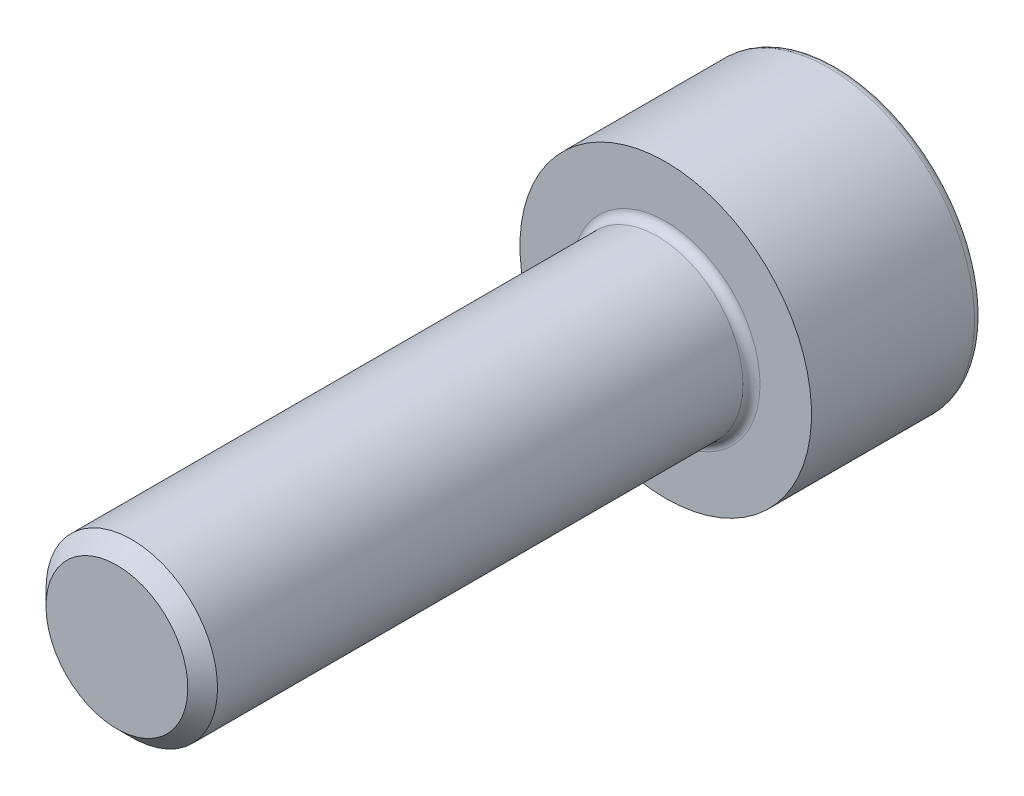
SolidWorks part; units mm, degrees
ref_plane "Plan1" through (0, 0, 0) normal (0, 0, 1) x (1, 0, 0)
ref_plane "Plan2" through (0, 0, 0) normal (0, 1, 0) x (1, 0, 0)
ref_plane "Plan3" through (0, 0, 0) normal (1, 0, 0) x (0, 0, -1)
sketch "Sketch1" plane through (0, 0, 0) normal (1, 0, 0) x (0, 0, -1)
  line L0 (5, 0) -> (-16, 0) construction
  line L1 (5, 0) -> (5, 4.25)
  line L2 (5, 4.25) -> (0, 4.25)
  line L3 (0, 4.25) -> (0, 2.5)
  line L4 (0, 2.5) -> (-16, 2.5)
  line L5 (-16, 2.5) -> (-16, 0)
  line L6 (-16, 0) -> (5, 0)
  line L7 (5, 0) -> (4.2, 0) construction
  dimension "DK" = 8.5
  dimension "L" = 16
  dimension "K" = 5
  dimension "D" = 5
  dimension "P" = 0.8
revolve "Base-Revolve" add sketch "Sketch1"
chamfer "Chamfer1" distance 0.433 angle 45 1 edges at (0, 2.5, 16)
fillet "Fillet1" radius 0.25 2 edges at (0, 4.25, -5) (0, 2.5, 0)
hole_wizard "Hole1" positions "Sketch3" profile "Sketch2" legacy
sketch "Sketch3" plane through (0, 0, -5) normal (0, 0, -1) x (-1, 0, 0)
  circle A0 centre (0, 0) radius 4.25 construction
  point P0 (0, 0)
sketch "Sketch2" plane through (0, 0, -5) normal (1, 0, 0) x (0, 1, 0)
  line L0 (0, 0) -> (0, 3.6547)
  line L1 (0, 3.6547) -> (2, 2.5)
  line L2 (2, 2.5) -> (2, 0)
  line L4 (2, 0) -> (0, 0)
  line L6 (0, 3.6547) -> (-2, 2.5) construction
  line L7 (0, -4.2442) -> (0, 117.3081) construction
  dimension "Diameter" = 4
  dimension "Depth" = 2.5
  dimension "Drill Angle" = 120
sketch "Sketch4" plane through (0, 0, -5) normal (0, 0, -1) x (-1, 0, 0)
  line L0 (0, -2) -> (0, 2) construction
  line L1 (2.3094, 0) -> (-2.3094, 0) construction
  line L2 (1.1547, 2) -> (-1.1547, 2)
  line L3 (-1.1547, 2) -> (-2.3094, 0)
  line L4 (-2.3094, 0) -> (-1.1547, -2)
  line L5 (-1.1547, -2) -> (1.1547, -2)
  line L6 (1.1547, -2) -> (2.3094, 0)
  line L7 (2.3094, 0) -> (1.1547, 2)
  dimension "D1" = 120
  dimension "S" = 4
extrude "Cut-Extrude1" cut sketch "Sketch4" against normal blind 2.5
equation "\"K@Sketch1\" = \"D@Sketch1\""
equation "\"D1@Fillet1\" = \"D@Sketch1\"*0.05"
equation "\"S@Sketch4\" = \"Diameter@Sketch2\""
equation "\"T@Cut-Extrude1\" = \"Depth@Sketch2\""
equation "\"D1@Cosmetic_Thread1\" = \"D@Sketch1\"-(1.0825*\"P@Sketch1\")"
equation "\"D1@Chamfer1\" = (\"D@Sketch1\"-\"D1@Cosmetic_Thread1\")/2"
